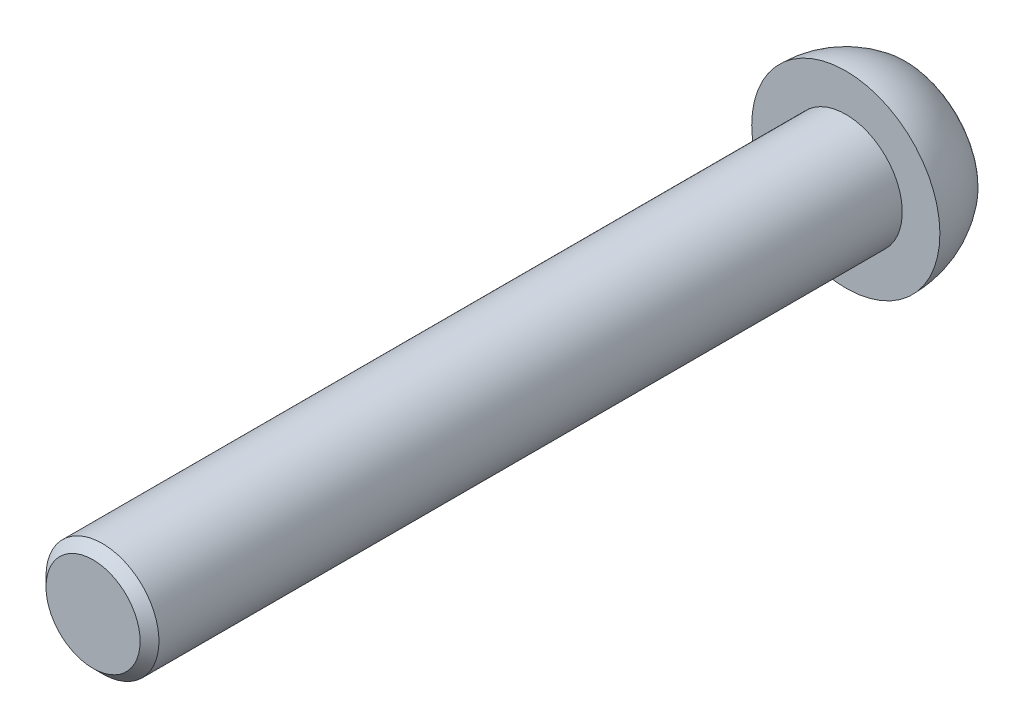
SolidWorks part; units mm, degrees
ref_plane "Face" through (0, 0, 0) normal (0, 0, 1) x (1, 0, 0)
ref_plane "Dessus" through (0, 0, 0) normal (0, 1, 0) x (1, 0, 0)
ref_plane "Droite" through (0, 0, 0) normal (1, 0, 0) x (0, 0, -1)
imported_body "Importée1"
sketch "Esquisse1" plane through (0, 0, -23) normal (0, 0, 1) x (1, 0, 0)
  circle A0 centre (-59.1026, 256.2254) radius 3 construction
  circle A1 centre (-59.1026, 256.2254) radius 3
extrude "Extrusion1" add sketch "Esquisse1" along normal blind 40
chamfer "Chanfrein1" distance 0.5 angle 45
